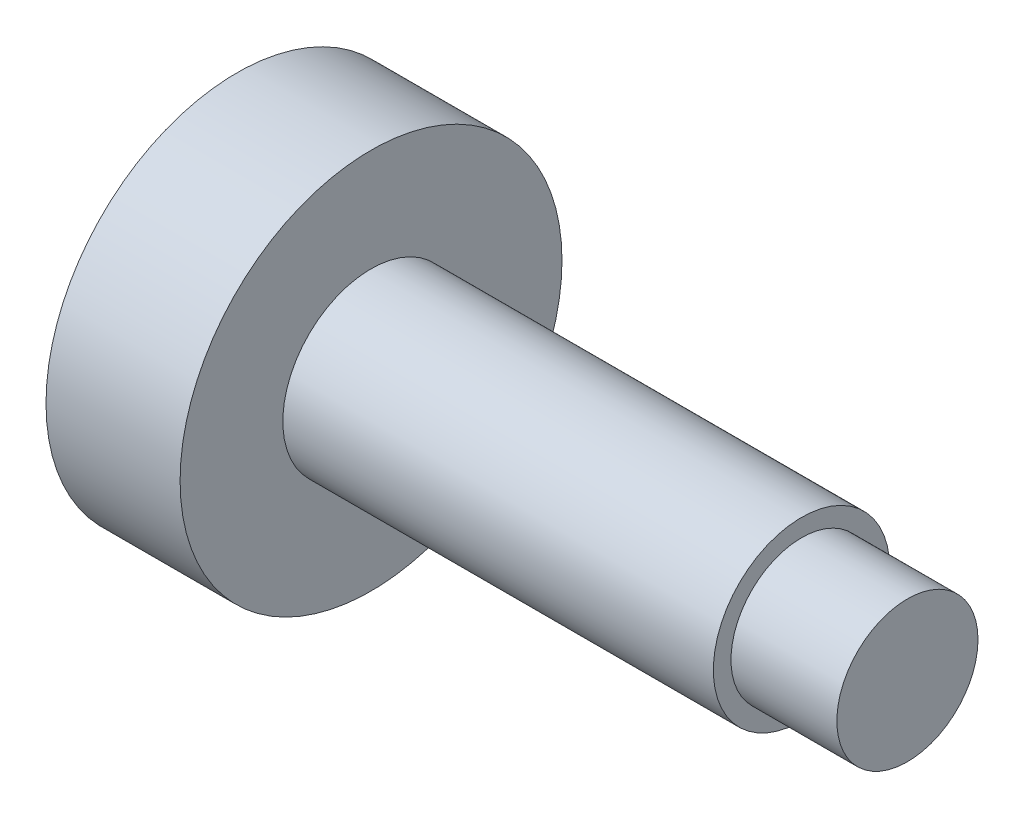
SolidWorks part; units mm, degrees
ref_plane "Plan de face" through (0, 0, 0) normal (0, 0, 1) x (1, 0, 0)
ref_plane "Plan de dessus" through (0, 0, 0) normal (0, 1, 0) x (1, 0, 0)
ref_plane "Plan de droite" through (0, 0, 0) normal (1, 0, 0) x (0, 0, -1)
sketch "Esquisse1" plane through (0, 0, 0) normal (0, 0, 1) x (1, 0, 0)
  line L0 (0, 0) -> (-137.6226, 0) construction
  line L2 (60, 0) -> (0, 0)
  line L3 (45, 10) -> (45, 12.5)
  line L4 (45, 12.5) -> (-16, 12.5)
  line L5 (45, 10) -> (60, 10)
  line L6 (0, 0) -> (-35, 0)
  line L7 (-16, 12.5) -> (-16, 27.055)
  line L8 (-16, 27.055) -> (-35, 27.055)
  line L9 (-35, 0) -> (-35, 27.055)
  line L12 (60, 10) -> (60, 0)
  dimension "D1" = 35
  dimension "D2" = 19
  dimension "D3" = 54.11
  dimension "D4" = 25
  dimension "D5" = 45
  dimension "D6" = 15
  dimension "D7" = 20
revolve "Révolution1" add sketch "Esquisse1" angle 360 about L0
sketch "Esquisse2" plane through (-35, 0, 0) normal (-1, 0, 0) x (0, 0, 1)
  line L0 (0, 0) -> (0, 28.9459) construction
  line L2 (-1, 23) -> (1, 23)
  line L3 (-3, 21) -> (-3, 5)
  line L4 (-1, 3) -> (1, 3)
  line L5 (3, 21) -> (3, 5)
  arc A0 (1, 23) -> (3, 21) centre (1, 21) cw
  arc A1 (-3, 21) -> (-1, 23) centre (-1, 21) cw
  arc A2 (-1, 3) -> (-3, 5) centre (-1, 5) cw
  arc A3 (3, 5) -> (1, 3) centre (1, 5) cw
  dimension "D2" = 2
  dimension "D1" = 6
  dimension "D3" = 20
  dimension "D4" = 3
extrude "Enlèv. mat.-Extru.1" cut sketch "Esquisse2" against normal blind 3
